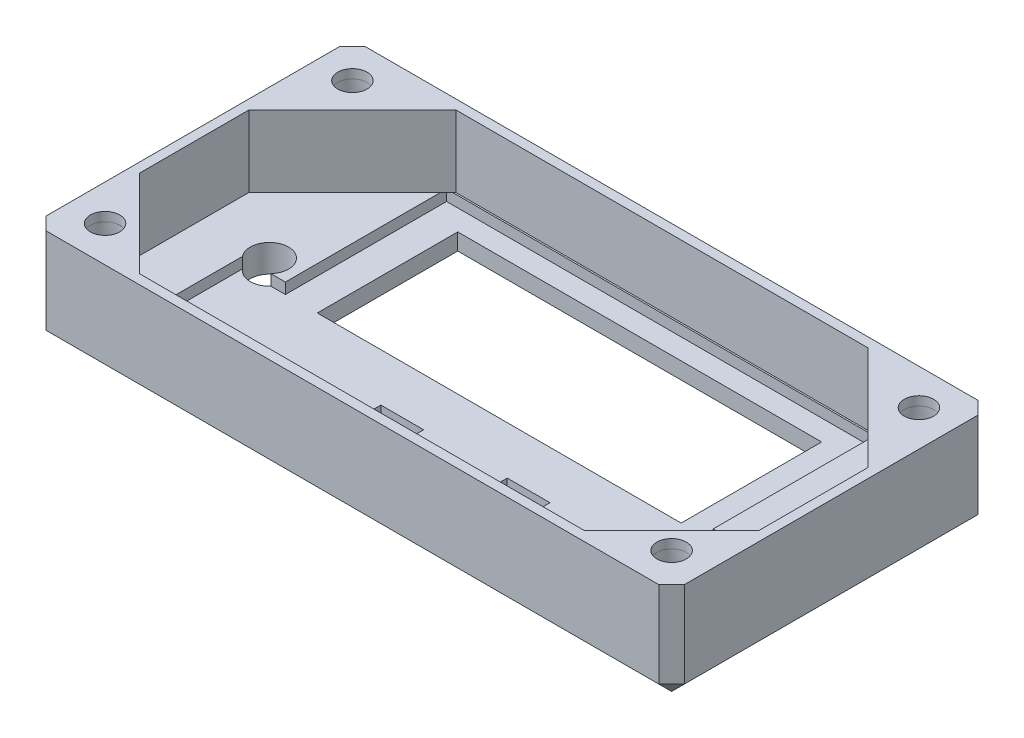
SolidWorks part; units mm, degrees
ref_plane "Front Plane" through (0, 0, 0) normal (0, 0, 1) x (1, 0, 0)
ref_plane "Top Plane" through (0, 0, 0) normal (0, 1, 0) x (1, 0, 0)
ref_plane "Right Plane" through (0, 0, 0) normal (1, 0, 0) x (0, 0, -1)
sketch "Sketch1" plane through (0, 0, 0) normal (0, 1, 0) x (1, 0, 0)
  line L0 (0, -8.5) -> (0, 0) construction
  line L1 (28.5, -10.5) -> (-28.5, -10.5)
  line L2 (28.5, -10.5) -> (28.5, 10.5)
  line L3 (28.5, 10.5) -> (-28.5, 10.5)
  line L4 (-28.5, -10.5) -> (-28.5, 10.5)
  line L5 (28.5, -10.5) -> (-28.5, 10.5) construction
  line L6 (28.5, 10.5) -> (-28.5, -10.5) construction
  line L7 (-50, -33.5) -> (50, -33.5)
  line L8 (-50, -33.5) -> (-50, 16.5)
  line L9 (-50, 16.5) -> (50, 16.5)
  line L10 (50, -33.5) -> (50, 16.5)
  line L11 (-50, -33.5) -> (50, 16.5) construction
  line L12 (-50, 16.5) -> (50, -33.5) construction
  line L13 (0, -13.5) -> (0, 0)
  line L14 (-37, -13.5) -> (37, -13.5) construction
  line L15 (-37, -13.5) -> (-37, -26.5) construction
  line L16 (-37, -26.5) -> (37, -26.5) construction
  line L17 (37, -13.5) -> (37, -26.5) construction
  line L18 (8.77, -24.715) -> (8.77, -18.015)
  line L19 (28.57, -24.715) -> (35.27, -24.715)
  line L20 (28.57, -24.715) -> (28.57, -18.015)
  line L21 (28.57, -18.015) -> (35.27, -18.015)
  line L22 (35.27, -24.715) -> (35.27, -18.015)
  line L23 (28.57, -24.715) -> (35.27, -18.015) construction
  line L24 (28.57, -18.015) -> (35.27, -24.715) construction
  line L25 (8.77, -24.715) -> (15.47, -24.715)
  line L26 (15.47, -24.715) -> (15.47, -18.015)
  line L27 (8.77, -18.015) -> (15.47, -18.015)
  line L28 (28.57, -24.715) -> (8.77, -24.715) construction
  line L29 (-11.03, -24.715) -> (-11.03, -18.015)
  line L30 (-11.03, -18.015) -> (-4.33, -18.015)
  line L31 (-4.33, -24.715) -> (-4.33, -18.015)
  line L32 (-11.03, -24.715) -> (-4.33, -24.715)
  line L33 (8.77, -24.715) -> (-11.03, -24.715) construction
  point P0 (0, 0)
  point P5 (0, -8.5)
  point P17 (31.92, -21.365)
  point P24 (35.27, -21.365)
  dimension "D8" = 6.7
  dimension "D1" = 57
  dimension "D2" = 21
  dimension "D3" = 100
  dimension "D4" = 50
  dimension "D5" = 6
  dimension "D6" = 74
  dimension "D7" = 13
  dimension "D9" = 6.7
  dimension "D10" = 5.135
  dimension "D11" = 5.08
  dimension "D12" = 6
  dimension "D14" = 19.8
  dimension "D16" = 19.8
  dimension "D13" = 2
  dimension "D15" = 2
extrude "Boss-Extrude1" add sketch "Sketch1" along normal blind 4.3
sketch "Sketch2" plane through (0, 4.3, 0) normal (0, 1, 0) x (1, 0, 0)
  line L0 (28.5, -10.5) -> (28.5, 10.5) construction
  line L1 (-28.5, -10.5) -> (-28.5, 10.5) construction
  line L4 (-28.5, -10.5) -> (-28.5, 10.5)
  line L5 (28.5, -10.5) -> (28.5, 10.5)
  line L6 (-33.5, -10.5) -> (-33.5, 14.75)
  line L7 (33.5, -10.5) -> (33.5, 14.75)
  line L8 (-33.5, 14.75) -> (33.5, 14.75)
  line L11 (-33.5, -10.5) -> (-28.5, -10.5)
  line L12 (28.5, -10.5) -> (33.5, -10.5)
  line L13 (-33.5, -10.5) -> (-33.5, 10.5) construction
  line L14 (33.5, -10.5) -> (33.5, 10.5) construction
  line L15 (-50, 16.5) -> (50, 16.5) construction
  line L16 (-28.5, 10.5) -> (28.5, 10.5)
  dimension "D1" = 5
  dimension "D2" = 5
  dimension "D3" = 1.75
sketch "Sketch4" plane through (0, 0, 0) normal (0, 1, 0) x (1, 0, 0)
  line L0 (-48.5, -32) -> (48.5, -32)
  line L1 (48.5, -32) -> (48.5, 15)
  line L2 (48.5, 15) -> (-48.5, 15)
  line L3 (-48.5, 15) -> (-48.5, -32)
  line L4 (-50, -33.5) -> (50, -33.5)
  line L5 (50, -33.5) -> (50, 16.5)
  line L6 (50, 16.5) -> (-50, 16.5)
  line L7 (-50, 16.5) -> (-50, -33.5)
  line L8 (-50, -33.5) -> (50, -33.5)
  line L9 (50, -33.5) -> (50, 16.5)
  line L10 (50, 16.5) -> (-50, 16.5)
  line L11 (-50, 16.5) -> (-50, -33.5)
  dimension "D1" = 0
  dimension "D2" = 1.5
sketch "Sketch5" plane through (0, 0, 0) normal (1, 0, 0) x (0, 0, -1)
  line L0 (16.5, 0) -> (-33.5, 0) construction
  line L1 (16.5, 0) -> (-33.5, 0) construction
  line L2 (-8.5, 0) -> (20.7216, 29.2216)
  line L3 (2.5325, 47.4107) -> (38.9107, 11.0325)
  point P6 (20.7216, 29.2216)
  dimension "D1" = 45
ref_plane "Plane1" [suppressed] through (0, 24.9716, -24.9716) normal (0, 0.7071, -0.7071) x (1, 0, 0)
extrude "Boss-Extrude4" add sketch "Sketch4" along normal blind 15.5
sketch "Sketch7" plane through (0, 4.3, 0) normal (0, 1, 0) x (1, 0, 0)
  line L0 (-50, 16.5) -> (50, -33.5) construction
  line L1 (-50, 16.5) -> (-50, -33.5) construction
  line L2 (-44.375, -27.875) -> (44.375, -27.875) construction
  line L3 (-44.375, -27.875) -> (-44.375, 10.875) construction
  line L4 (-44.375, 10.875) -> (44.375, 10.875) construction
  line L5 (44.375, -27.875) -> (44.375, 10.875) construction
  line L6 (-44.375, -27.875) -> (44.375, 10.875) construction
  line L7 (-44.375, 10.875) -> (44.375, -27.875) construction
  line L8 (50, 16.5) -> (-50, 16.5) construction
  line L9 (0, -8.5) -> (0, 16.5) construction
  line L10 (0, -8.5) -> (-50, -8.5) construction
  line L11 (-48.5, -1.205) -> (-32.295, 15)
  line L12 (-48.5, 15) -> (-48.5, -32) construction
  line L13 (48.5, 15) -> (-48.5, 15) construction
  line L14 (-32.295, 15) -> (-48.5, 15)
  line L15 (-48.5, 15) -> (-48.5, -1.205)
  line L16 (32.295, 15) -> (48.5, 15)
  line L17 (48.5, -1.205) -> (32.295, 15)
  line L18 (48.5, 15) -> (48.5, -1.205)
  line L19 (48.5, -15.795) -> (32.295, -32)
  line L20 (48.5, -32) -> (48.5, -15.795)
  line L21 (32.295, -32) -> (48.5, -32)
  line L22 (-32.295, -32) -> (-48.5, -32)
  line L23 (-48.5, -15.795) -> (-32.295, -32)
  line L24 (-48.5, -32) -> (-48.5, -15.795)
  circle A1 centre (-44.375, 10.875) radius 3.75 construction
  circle A2 centre (44.375, 10.875) radius 3.75 construction
  circle A3 centre (44.375, -27.875) radius 3.75 construction
  circle A4 centre (-44.375, -27.875) radius 3.75 construction
  point P2 (0, -8.5)
extrude "Boss-Extrude5" add sketch "Sketch7" along normal up to surface (11.2 mm away)
sketch "Sketch8" plane through (0, 15.5, 0) normal (0, 1, 0) x (1, 0, 0)
  circle A0 centre (-44.375, 10.875) radius 2.3
  circle A1 centre (44.375, 10.875) radius 2.3
  circle A2 centre (44.375, -27.875) radius 2.3
  circle A3 centre (-44.375, -27.875) radius 2.3
  point P0 (44.375, 10.875)
  point P2 (44.375, -27.875)
  point P4 (-44.375, -27.875)
  point P6 (-44.375, 10.875)
  dimension "D1" = 4.6
extrude "Cut-Extrude1" cut sketch "Sketch8" against normal through all
sketch "Sketch9" plane through (0, 0, 0) normal (0, -1, 0) x (1, 0, 0)
  circle A0 centre (-44.375, 27.875) radius 3.5
  circle A1 centre (44.375, 27.875) radius 3.5
  circle A2 centre (44.375, -10.875) radius 3.5
  circle A3 centre (-44.375, -10.875) radius 3.5
  dimension "D1" = 7
extrude "Cut-Extrude2" cut sketch "Sketch9" against normal blind 4
sketch "Sketch10" plane through (0, 4, 0) normal (0, -1, 0) x (1, 0, 0)
  circle A0 centre (-44.375, -10.875) radius 3.5 construction
  circle A1 centre (44.375, -10.875) radius 3.5 construction
  circle A2 centre (44.375, 27.875) radius 3.5 construction
  circle A4 centre (-44.375, -10.875) radius 3.5 construction
  circle A5 centre (44.375, -10.875) radius 3.5 construction
  circle A6 centre (44.375, 27.875) radius 3.5 construction
  circle A8 centre (-44.375, 27.875) radius 3
  circle A9 centre (-44.375, 27.875) radius 3.5 construction
  dimension "D1" = 0.5
sketch "Sketch11" plane through (0, 15.5, 0) normal (0, 1, 0) x (1, 0, 0)
  circle A0 centre (44.375, -27.875) radius 2.3 construction
  circle A1 centre (44.375, 10.875) radius 2.3 construction
  circle A2 centre (-44.375, -27.875) radius 2.3 construction
  circle A3 centre (-44.375, 10.875) radius 2.3 construction
  circle A4 centre (44.375, -27.875) radius 2.3 construction
  circle A5 centre (44.375, 10.875) radius 2.3 construction
  circle A6 centre (-44.375, -27.875) radius 2.3
  circle A7 centre (-44.375, 10.875) radius 2.3 construction
loft "Cut-Loft1" cut profiles "Sketch10", "Sketch11"
mirror "Mirror1" about plane through (0, 0, 0) normal (1, 0, 0) of "Cut-Loft1"
ref_plane "Plane2" through (0, 0, 8.5) normal (0, 0, 1) x (1, 0, 0)
mirror "Mirror2" about plane through (0, 0, 8.5) normal (0, 0, 1) of "Mirror1", "Cut-Loft1"
chamfer "Chamfer1" distance 2 angle 45 8 edges at (-50, 7.75, 33.5) (-50, 7.75, -16.5) (50, 7.75, -16.5) (50, 7.75, 33.5) (-50, 0, 8.5) (0, 0, -16.5) (50, 0, 8.5) (0, 0, 33.5)
sketch "Sketch14" plane through (0, 0, 0) normal (0, -1, 0) x (1, 0, 0)
  line L0 (-50, -14.5) -> (-50, 31.5) construction
  line L1 (-48, 33.5) -> (48, 33.5) construction
  circle A0 centre (-38, 8.5) radius 3
  dimension "D1" = 6
  dimension "D2" = 12
  dimension "D3" = 25
extrude "Cut-Extrude4" cut sketch "Sketch14" against normal up to next
sketch "Sketch12" plane through (0, 0, 0) normal (0, -1, 0) x (1, 0, 0)
  line L0 (36.3439, 31.215) -> (27.4961, 31.215) construction
  line L1 (27.4961, 31.215) -> (20.2698, 31.215) construction
  line L2 (20.2698, 31.215) -> (3.9702, 31.215) construction
  line L3 (3.9702, 31.215) -> (12.6326, 31.215) construction
  line L4 (12.6326, 31.215) -> (-27.9926, 31.215) construction
  line L5 (-7.68, 31.215) -> (-7.68, 24.715) construction
  line L6 (-11.03, 24.715) -> (-4.33, 24.715) construction
  line L7 (8.77, 24.715) -> (15.47, 24.715) construction
  line L8 (12.12, 31.215) -> (12.12, 24.715) construction
  line L9 (31.92, 24.715) -> (31.92, 31.215) construction
  line L10 (28.57, 24.715) -> (35.27, 24.715) construction
  line L11 (-38, 8.5) -> (-38, 18.5) construction
  line L12 (-25.57, 18.5) -> (-50.43, 18.5) construction
  text T0 "<b>+</b>" font "Century Gothic" height 7
  text T1 "<b>-</b>" font "Century Gothic" height 7
  text T2 "<b>ENTER</b>" font "Century Gothic" height 5
  text T3 "<b>PWR</b>  " font "Century Gothic" height 5
  point P25 (-38, 18.5)
  dimension "D1" = 6.5
  dimension "D2" = 10
extrude "Cut-Extrude5" cut sketch "Sketch12" against normal blind 1.6
extrude "Cut-Extrude6" cut sketch "Sketch2" against normal blind 1.7
sketch "Sketch15" plane through (0, 2.6, 0) normal (0, 1, 0) x (1, 0, 0)
  line L0 (-28.5, 10.5) -> (-28.5, 11.5)
  line L1 (-28.5, 11.5) -> (28.5, 11.5)
  line L2 (28.5, 11.5) -> (28.5, 10.5)
  line L3 (-28.5, 10.5) -> (28.5, 10.5) construction
  line L4 (-28.5, 10.5) -> (28.5, 10.5)
  dimension "D1" = 1
extrude "Cut-Extrude7" cut sketch "Sketch15" against normal through all
sketch "Sketch16" plane through (0, 4.3, 0) normal (0, 1, 0) x (1, 0, 0)
  line L0 (-37, -13.5) -> (-37, -26.5) construction
  line L1 (-37, -26.5) -> (37, -26.5) construction
  line L2 (37, -13.5) -> (37, -26.5) construction
  line L3 (-37, -13.5) -> (37, -13.5) construction
  line L4 (-37, -13.5) -> (-37, -26.5) construction
  line L5 (-37, -26.5) -> (37, -26.5)
  line L6 (37, -13.5) -> (37, -26.5)
  line L7 (36.9, -13.5) -> (37, -13.5)
  line L8 (-37, -13.5) -> (-37, -10.5) construction
  line L9 (-37, -10.5) -> (36.9, -10.5)
  line L10 (36.9, -10.5) -> (36.9, -13.5)
  line L11 (-37, -10.5) -> (-37, -26.5)
  dimension "D1" = 3
  dimension "D2" = 73.9
extrude "Cut-Extrude10" cut sketch "Sketch16" against normal blind 1.7
sketch "Sketch17" plane through (0, 4.3, 0) normal (0, 1, 0) x (1, 0, 0)
  line L0 (-37, -11.3284) -> (-38, -14.5)
  line L1 (-38, -14.5) -> (-38, -26.5)
  line L2 (-38, -26.5) -> (-37, -26.5)
  line L3 (37, -13.5) -> (38, -13.5)
  line L4 (38, -13.5) -> (38, -26.5)
  line L5 (38, -26.5) -> (37, -26.5)
  line L6 (37, -26.5) -> (37, -13.5) construction
  line L7 (37, -26.5) -> (37, -13.5)
  line L8 (-37, -11.3284) -> (-37, -26.5) construction
  line L9 (-37, -11.3284) -> (-37, -26.5)
  dimension "D1" = 1
  dimension "D2" = 12
  dimension "D3" = 1
extrude "Cut-Extrude11" cut sketch "Sketch17" against normal blind 1.7
sketch "Croquis1" plane through (0, 15.5, 0) normal (0, 1, 0) x (1, 0, 0)
  line L0 (48.5, -15.795) -> (48.5, -18.3406)
  line L1 (48.5, -18.3406) -> (34.8406, -32)
  line L2 (34.8406, -32) -> (32.295, -32)
  line L3 (0, 0) -> (0, -7.1261) construction
  line L5 (48.5, -15.795) -> (32.295, -32) construction
  line L6 (48.5, -15.795) -> (38, -26.295) construction
  line L7 (48.5, -15.795) -> (32.295, -32)
  line L8 (-48.5, -15.795) -> (-48.5, -18.3406)
  line L9 (-48.5, -18.3406) -> (-34.8406, -32)
  line L10 (-34.8406, -32) -> (-32.295, -32)
  line L11 (-48.5, -15.795) -> (-32.295, -32)
  dimension "D1" = 1.8
extrude "Cortar-Extruir1" cut sketch "Croquis1" against normal up to surface (11.2 mm away)
sketch "Croquis2" plane through (0, 4.3, 0) normal (0, 1, 0) x (1, 0, 0)
  line L0 (36.9, -10.5) -> (40.3406, -10.5)
  line L1 (40.3406, -10.5) -> (40.3406, -26.5)
  line L2 (48.5, -18.3406) -> (34.8406, -32) construction
  line L3 (40.3406, -26.5) -> (38, -26.5)
  line L4 (38, -26.5) -> (38, -13.5)
  line L5 (38, -13.5) -> (36.9, -13.5)
  line L6 (36.9, -13.5) -> (36.9, -10.5)
  line L7 (-38, -26.5) -> (-40.3406, -26.5)
  line L8 (-48.5, -18.3406) -> (-34.8406, -32) construction
  line L9 (-40.3406, -26.5) -> (-40.3406, -10.3765)
  line L10 (-37, -11.3284) -> (-38, -14.5)
  line L11 (-38, -14.5) -> (-38, -26.5)
  arc A0 (-35.7639, -10.5) -> (-37, -11.3284) centre (-38, -8.5) ccw construction
  arc A1 (-40.3406, -10.3765) -> (-37, -11.3284) centre (-38, -8.5) ccw
extrude "Cortar-Extruir2" cut sketch "Croquis2" against normal up to surface (1.7 mm away)
chamfer "Chaflán1" distance 1.7 angle 45 1 edges at (0, 4.3, 26.5)
equation "\"D2@Sketch7\"=\"D1@Sketch7\"*.75"
equation "\"D3@Sketch7\"=\"D2@Sketch7\""
equation "\"D4@Sketch7\"=\"D3@Sketch7\""
